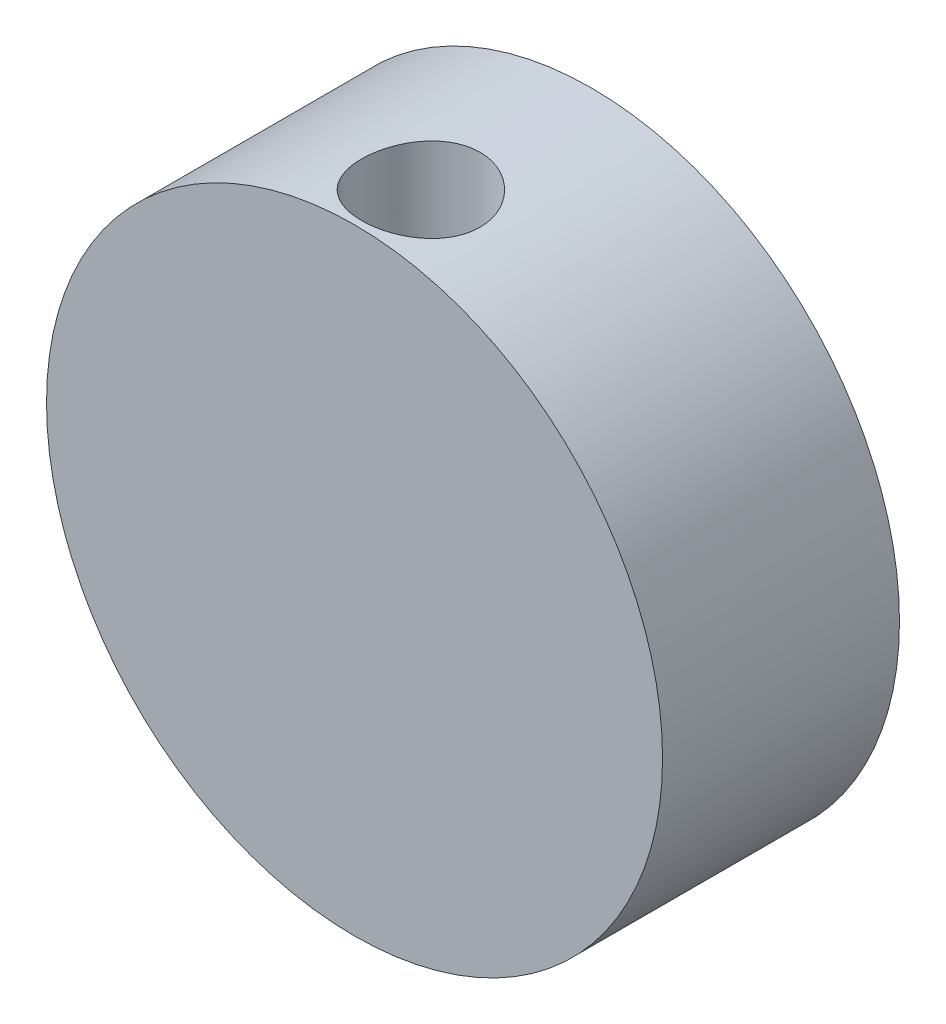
SolidWorks part; units mm, degrees
ref_plane "Front Plane" through (0, 0, 0) normal (0, 0, 1) x (1, 0, 0)
ref_plane "Top Plane" through (0, 0, 0) normal (0, 1, 0) x (1, 0, 0)
ref_plane "Right Plane" through (0, 0, 0) normal (1, 0, 0) x (0, 0, -1)
sketch "Sketch1" plane through (0, 0, 0) normal (0, 0, 1) x (1, 0, 0)
  circle A0 centre (0, 0) radius 65
  dimension "D1" = 130
extrude "Boss-Extrude1" add sketch "Sketch1" along normal blind 50
sketch "Sketch2" plane through (0, 0, 0) normal (0, 0, -1) x (-1, 0, 0)
  circle A0 centre (0, 0) radius 50
  dimension "D1" = 100
sketch "Sketch4" plane through (0, 0, 0) normal (0, 1, 0) x (1, 0, 0)
  circle A0 centre (0, -36) radius 12.5
  dimension "D1" = 25
  dimension "D2" = 36
extrude "Cut-Extrude3" cut sketch "Sketch4" against normal mid plane 133
extrude "Cut-Extrude4" cut sketch "Sketch2" against normal blind 10
sketch "Sketch5" plane through (0, 0, 10) normal (0, 0, -1) x (-1, 0, 0)
  circle A0 centre (0, 0) radius 60
extrude "Cut-Extrude5" cut sketch "Sketch5" against normal blind 10
